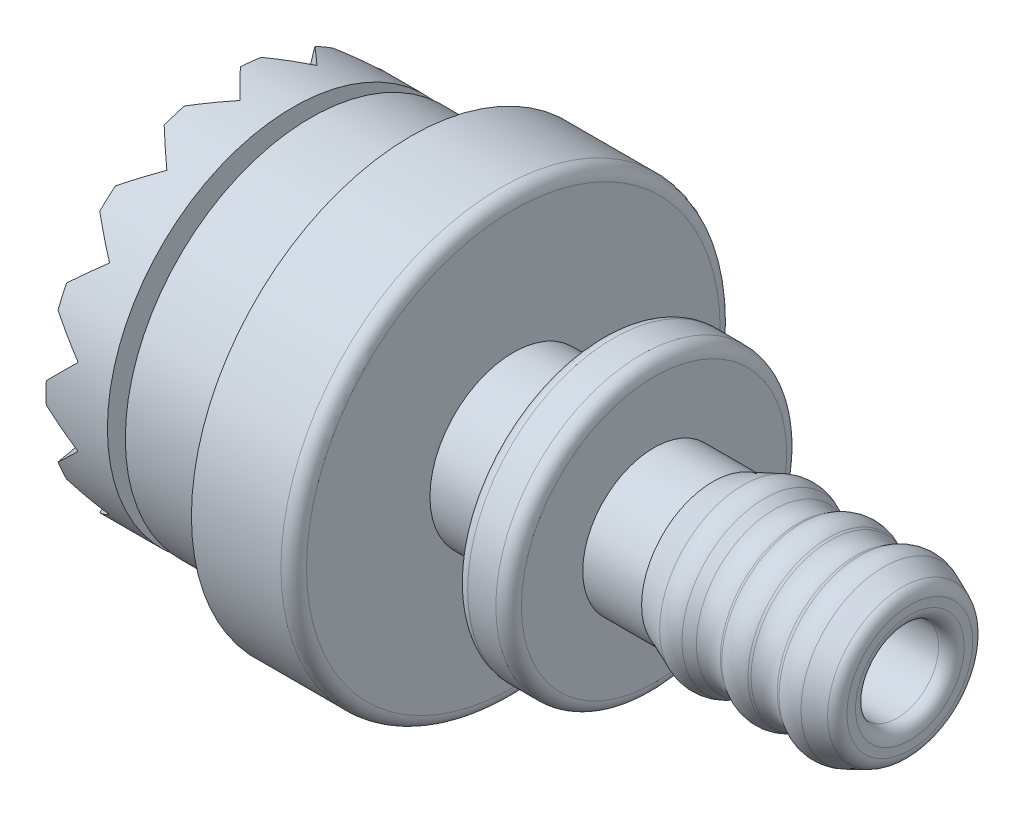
SolidWorks part; units mm, degrees
ref_plane "Plan de Face" through (0, 0, 0) normal (0, 0, 1) x (1, 0, 0)
ref_plane "Plan de Dessus" through (0, 0, 0) normal (0, 1, 0) x (1, 0, 0)
ref_plane "Plan de Droite" through (0, 0, 0) normal (1, 0, 0) x (0, 0, -1)
sketch "Esquisse1" plane through (0, 0, 0) normal (0, 0, 1) x (1, 0, 0)
  line L0 (0, 7.25) -> (0, 5.6)
  line L1 (0, 7.25) -> (2.4, 7.25)
  line L2 (6.0196, 7.25) -> (7.0196, 7.25)
  line L3 (7.0196, 7.25) -> (7.0196, 8.585)
  line L4 (2.4, 7.25) -> (2.4, 5.85)
  line L5 (2.4, 5.85) -> (3.1, 5.85)
  line L6 (3.1, 5.85) -> (3.1, 7.25)
  line L7 (7.0196, 8.585) -> (11.0196, 8.585)
  line L8 (8.2754, 1.625) -> (6.5, 4.7)
  line L9 (11.0196, 8.585) -> (11.0196, 3.26)
  line L10 (26.52, 2.785) -> (26.52, 1.625)
  line L11 (3.1, 7.25) -> (6.0196, 7.25)
  line L12 (11.0196, 3.26) -> (14.4196, 3.26)
  line L13 (26.52, 1.625) -> (8.2754, 1.625)
  line L14 (6.5, 4.7) -> (1.5588, 4.7)
  line L15 (0, 5.6) -> (1.5588, 4.7)
  line L16 (14.4196, 3.26) -> (14.4196, 5.685)
  line L17 (14.4196, 5.685) -> (16.5196, 5.685)
  line L18 (16.5196, 5.685) -> (16.5196, 2.785)
  line L19 (16.5196, 2.785) -> (18.8196, 2.785)
  line L20 (0, 0) -> (20.8103, 0) construction
  line L21 (18.8196, 2.785) -> (20.0062, 3.2666)
  line L22 (20.8411, 3.2286) -> (21.2111, 3.0376)
  line L23 (22.1753, 3.0632) -> (22.3067, 3.1402)
  line L24 (23.326, 3.1352) -> (23.4023, 3.0895)
  line L25 (24.4217, 3.0844) -> (24.588, 3.1818)
  line L26 (25.4953, 3.2347) -> (26.52, 2.785)
  arc A0 (25.4953, 3.2347) -> (24.588, 3.1818) centre (25.0934, 2.3189) ccw
  arc A1 (24.4217, 3.0844) -> (23.4023, 3.0895) centre (23.9163, 3.9473) cw
  arc A2 (23.326, 3.1352) -> (22.3067, 3.1402) centre (22.8121, 2.2773) ccw
  arc A3 (22.1753, 3.0632) -> (21.2111, 3.0376) centre (21.6699, 3.9261) cw
  arc A4 (20.8411, 3.2286) -> (20.0062, 3.2666) centre (20.3823, 2.34) ccw
  dimension "D21" = 2.3
  dimension "D15" = 6.5
  dimension "D17" = 60
  dimension "D12" = 3.4
  dimension "D14" = 9.4
  dimension "D18" = 30
  dimension "D20" = 2.9
  dimension "D22" = 1
  dimension "D2" = 14.5
  dimension "D3" = 26.52
  dimension "D4" = 3.25
  dimension "D5" = 11.2
  dimension "D6" = 11.7
  dimension "D7" = 1
  dimension "D8" = 2.4
  dimension "D9" = 1.335
  dimension "D10" = 4
  dimension "D11" = 5.325
  dimension "D13" = 2.425
  dimension "D16" = 0.7
  dimension "D19" = 2.1
revolve "Révolution1" add sketch "Esquisse1" angle 360 about L20
sketch "Esquisse4" plane through (0, 0, 0) normal (0, 0, 1) x (1, 0, 0)
  line L0 (0, 0) -> (1.8582, 0) construction
  line L1 (0, -1.1) -> (1.1, 0)
  line L3 (1.1, 0) -> (0, 1.1)
  line L4 (0, 1.1) -> (0, -1.1)
  line L5 (0, 7.25) -> (0, -7.25) construction
  dimension "D1" = 1.1
  dimension "D2" = 45
extrude "Extrusion3" cut sketch "Esquisse4" against normal through all
fillet "Congé1" radius 0.5 5 edges at (26.52, 0, 1.625) (16.5196, 0, 5.685) (14.4196, 0, 5.685) (11.0196, 0, 8.585) (26.52, 0, 2.785)
pattern_circular "Répétition circulaire1" count 15 over 360 about axis through (0, 0, 0) along (1, 0, 0) of "Extrusion3"
